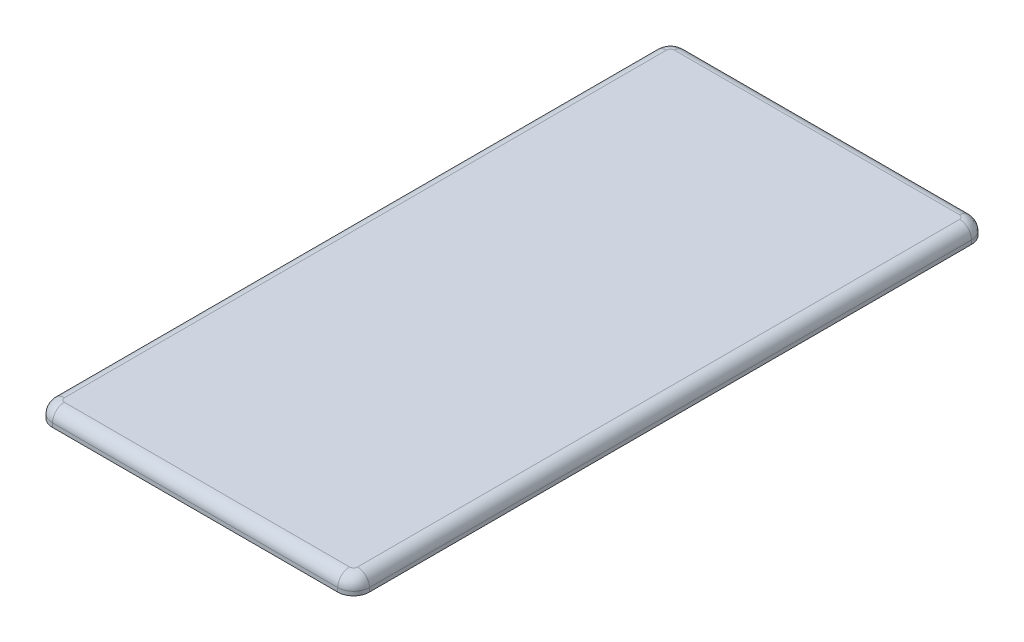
SolidWorks part; units mm, degrees
other "<10005-01-0000-00_abdeckkappe_16080>-<Schnitt-Linear austragen2>"
ref_plane "Ebene vorne" through (0, 0, 0) normal (0, 0, 1) x (1, 0, 0)
ref_plane "Ebene oben" through (0, 0, 0) normal (0, 1, 0) x (1, 0, 0)
ref_plane "Ebene rechts" through (0, 0, 0) normal (1, 0, 0) x (0, 0, -1)
inserted part "10005-01-0000-00_abdeckkappe_16080"
other "Fläche verschieben4" parameters "D1"=90
